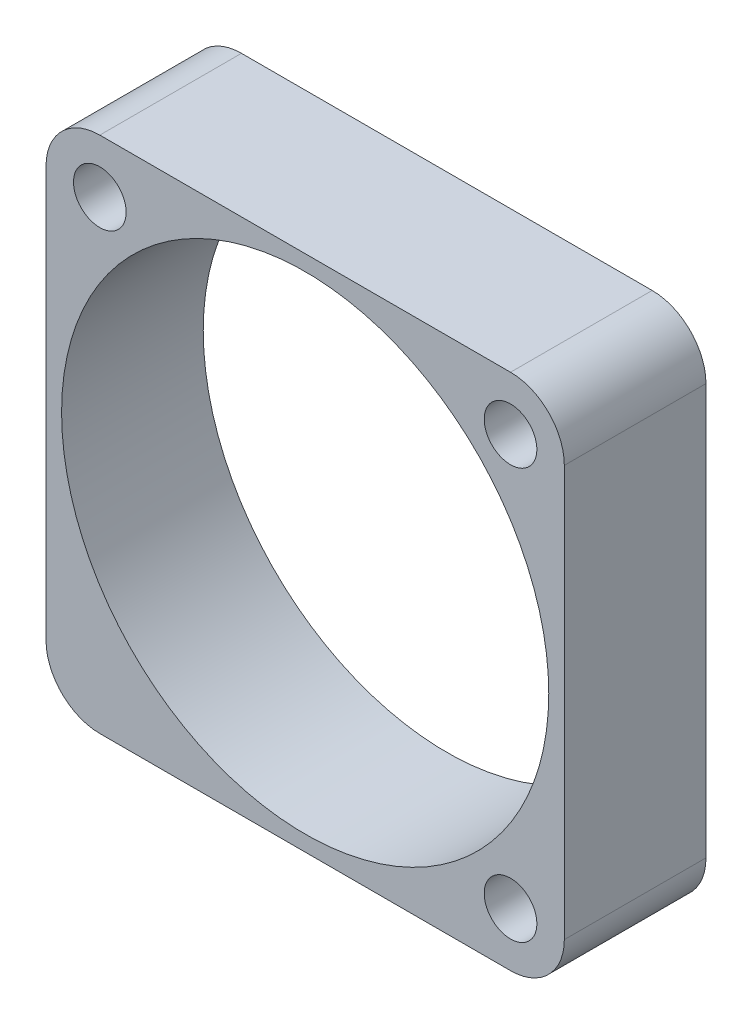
SolidWorks part; units mm, degrees
ref_plane "Front Plane" through (0, 0, 0) normal (0, 0, 1) x (1, 0, 0)
ref_plane "Top Plane" through (0, 0, 0) normal (0, 1, 0) x (1, 0, 0)
ref_plane "Right Plane" through (0, 0, 0) normal (1, 0, 0) x (0, 0, -1)
sketch "Sketch1" plane through (0, 0, 0) normal (0, 0, 1) x (1, 0, 0)
  line L1 (0, 0) -> (25, 0)
  line L2 (0, 0) -> (0, 25)
  line L3 (0, 25) -> (25, 25)
  line L4 (25, 0) -> (25, 25)
  dimension "D1" = 25
extrude "Boss-Extrude1" add sketch "Sketch1" along normal blind 6.8325
sketch "Sketch2" plane through (0, 0, 6.8325) normal (0, 0, 1) x (1, 0, 0)
  line L0 (12.5, 25) -> (12.5, 0) construction
  line L1 (25, 25) -> (0, 25) construction
  line L2 (0, 0) -> (25, 0) construction
  line L3 (0, 12.5) -> (25, 12.5) construction
  line L4 (0, 25) -> (0, 0) construction
  line L5 (25, 0) -> (25, 25) construction
  circle A0 centre (12.5, 12.5) radius 11.75
  dimension "D1" = 23.5
extrude "Cut-Extrude1" cut sketch "Sketch2" against normal through all
sketch "Sketch3" plane through (0, 0, 6.8325) normal (0, 0, 1) x (1, 0, 0)
  line L0 (12.5, 25) -> (12.5, 0) construction
  line L1 (25, 25) -> (0, 25) construction
  line L2 (0, 0) -> (25, 0) construction
  line L3 (2.594, 22.406) -> (12.5, 22.406) construction
  line L4 (0, 12.5) -> (25, 12.5) construction
  line L5 (0, 25) -> (0, 0) construction
  line L6 (25, 0) -> (25, 25) construction
  line L7 (2.594, 22.406) -> (2.594, 12.5) construction
  line L8 (12.5, 12.5) -> (2.594, 22.406) construction
  line L9 (12.5, 12.5) -> (22.406, 22.406) construction
  circle A0 centre (2.594, 22.406) radius 1.27
  circle A1 centre (22.406, 22.406) radius 1.27
  circle A2 centre (22.406, 2.594) radius 1.27
  point P15 (12.5, 12.5)
  dimension "D1" = 2.54
  dimension "D2" = 9.906
  dimension "D4" = 90
  dimension "D3" = 3
extrude "Cut-Extrude2" cut sketch "Sketch3" against normal through all
sketch "Sketch4" plane through (0, 0, 6.8325) normal (0, 0, 1) x (1, 0, 0)
  line L0 (25, 25) -> (0, 25) construction
  line L1 (25, 0) -> (25, 25) construction
  line L2 (22.406, 25) -> (25, 25)
  line L3 (25, 25) -> (25, 22.406)
  line L4 (12.5, 24.25) -> (12.5, 0.75) construction
  line L5 (25, 2.594) -> (25, 0)
  line L6 (25, 0) -> (22.406, 0)
  line L7 (2.594, 0) -> (0, 0)
  line L8 (0, 0) -> (0, 2.594)
  line L9 (0, 22.406) -> (0, 25)
  line L10 (0, 25) -> (2.594, 25)
  arc A0 (22.406, 25) -> (25, 22.406) centre (22.406, 22.406) cw
  circle A1 centre (12.5, 12.5) radius 11.75 construction
  arc A2 (25, 2.594) -> (22.406, 0) centre (22.406, 2.594) cw
  arc A3 (2.594, 0) -> (0, 2.594) centre (2.594, 2.594) cw
  arc A4 (0, 22.406) -> (2.594, 25) centre (2.594, 22.406) cw
  point P15 (12.5, 12.5)
  point P31 (12.5, 12.5)
  dimension "D1" = 4
extrude "Cut-Extrude3" cut sketch "Sketch4" against normal through all
